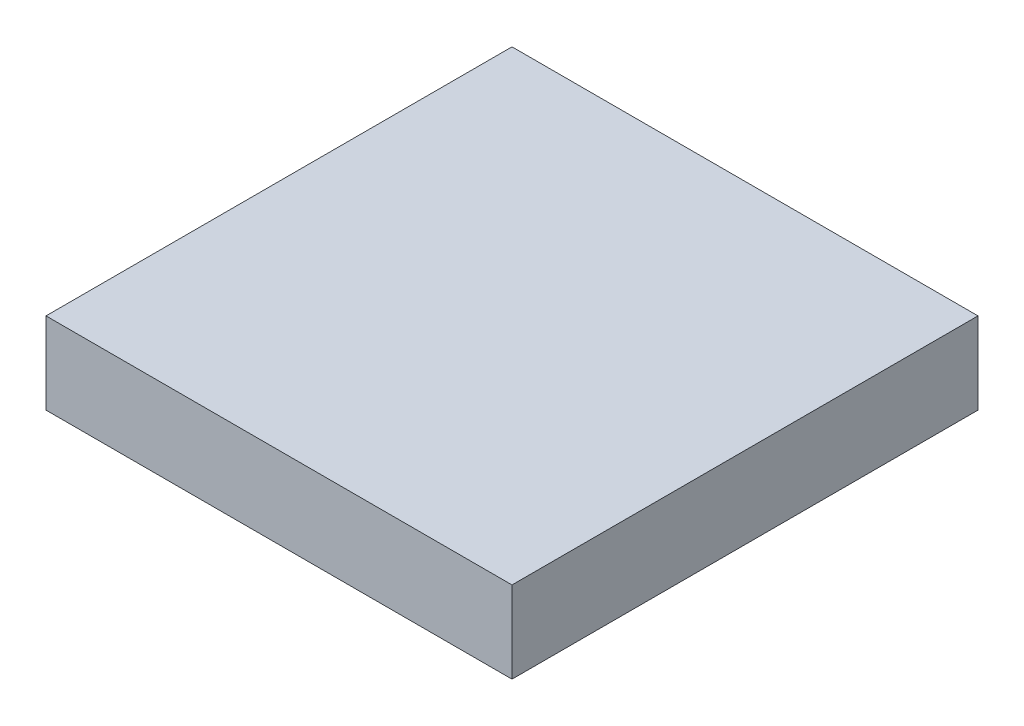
SolidWorks part; units mm, degrees
ref_plane "Front Plane" through (0, 0, 0) normal (1, 0, 0) x (0, 1, 0)
ref_plane "Top Plane" through (0, 0, 0) normal (0, 0, 1) x (0, 1, 0)
ref_plane "Right Plane" through (0, 0, 0) normal (0, 1, 0) x (-1, 0, 0)
sketch "sk w193" plane through (0, 0, 0) normal (0, 0, 1) x (0, 1, 0)
  point P0 (-399.034, -196.596)
  point P3 (-188.214, 0)
  line B0 (-399.034, -196.596) -> (-399.034, -160.02)
  line B1 (-399.034, -160.02) -> (-226.06, -160.02)
  line B2 (-210.82, -144.78) -> (-210.82, 144.78)
  line B3 (-226.06, 160.02) -> (-399.034, 160.02)
  line B4 (-399.034, 160.02) -> (-399.034, 196.596)
  line B5 (-399.034, 196.596) -> (0, 196.596)
  line B6 (0, 196.596) -> (0, 160.02)
  line B7 (0, 160.02) -> (-172.974, 160.02)
  line B8 (-188.214, 144.78) -> (-188.214, -144.78)
  line B9 (-172.974, -160.02) -> (0, -160.02)
  line B10 (0, -160.02) -> (0, -196.596)
  line B11 (0, -196.596) -> (-399.034, -196.596)
  arc B12 (-226.06, -160.02) -> (-210.82, -144.78) centre (-226.06, -144.78) ccw
  arc B13 (-210.82, 144.78) -> (-226.06, 160.02) centre (-226.06, 144.78) ccw
  arc B14 (-172.974, 160.02) -> (-188.214, 144.78) centre (-172.974, 144.78) ccw
  arc B15 (-188.214, -144.78) -> (-172.974, -160.02) centre (-172.974, -144.78) ccw
sketch_block_instance "w14x193-1-1"
sketch_block "w14x193-1" parameters "D4"=15.24, "D1"=399.034, "D2"=393.192, "D3"=22.606, "D5"=36.576
sketch "Sketch2" plane through (0, 0, 0) normal (0, 0, 1) x (0, 1, 0)
  line L0 (320, 501.4782) -> (320, -809.7231)
  line L1 (-188.214, 144.78) -> (-188.214, -144.78)
  line L2 (-188.214, -144.78) -> (-172.974, -160.02)
  line L3 (-172.974, -160.02) -> (5, -160.02)
  line L4 (-188.214, 144.78) -> (-172.974, 160.02)
  line L5 (-172.974, 160.02) -> (5, 160.02)
  line L6 (5, 201.596) -> (5, 160.02)
  line L7 (0, 196.596) -> (0, 160.02) construction
  line L8 (5, -160.02) -> (5, -201.596)
  line L9 (-285.82, 201.596) -> (5, 201.596)
  line L10 (-285.82, -201.596) -> (5, -201.596)
  line L11 (-285.82, 201.596) -> (-285.82, 239.696)
  line L12 (-285.82, 239.696) -> (167.6, 501.4782)
  line L13 (-285.82, -201.596) -> (-285.82, -239.696)
  line L14 (-285.82, -239.696) -> (167.6, -809.7231)
  line L15 (-210.82, -144.78) -> (-210.82, 144.78) construction
  line L16 (-399.034, 196.596) -> (0, 196.596) construction
  line L17 (0, -196.596) -> (-399.034, -196.596) construction
  line L18 (320, 501.4782) -> (167.6, 501.4782)
  line L19 (320, -809.7231) -> (167.6, -809.7231)
  point P30 (320, 501.4782)
  point P31 (320, -809.7231)
  dimension "D1" = 320
  dimension "D2" = 5
  dimension "D3" = 75
  dimension "D4" = 5
  dimension "D5" = 5
  dimension "D6" = 30
  dimension "D7" = 51.5
  dimension "D8" = 38.1
  dimension "D9" = 38.1
  dimension "D10" = 152.4
sketch "Sketch3" plane through (0, 0, 0) normal (0, 1, 0) x (-1, 0, 0)
  line L6 (-145, 145) -> (145, 145)
  line L7 (-145, 145) -> (-145, -145)
  line L8 (-145, -145) -> (145, -145)
  line L9 (145, 145) -> (145, -145)
  point P4 (0, 145)
  point P5 (145, 0)
  dimension "D1" = 290
  dimension "D2" = 290
extrude "Boss-Extrude1" add sketch "Sketch3" along normal blind 50.8
